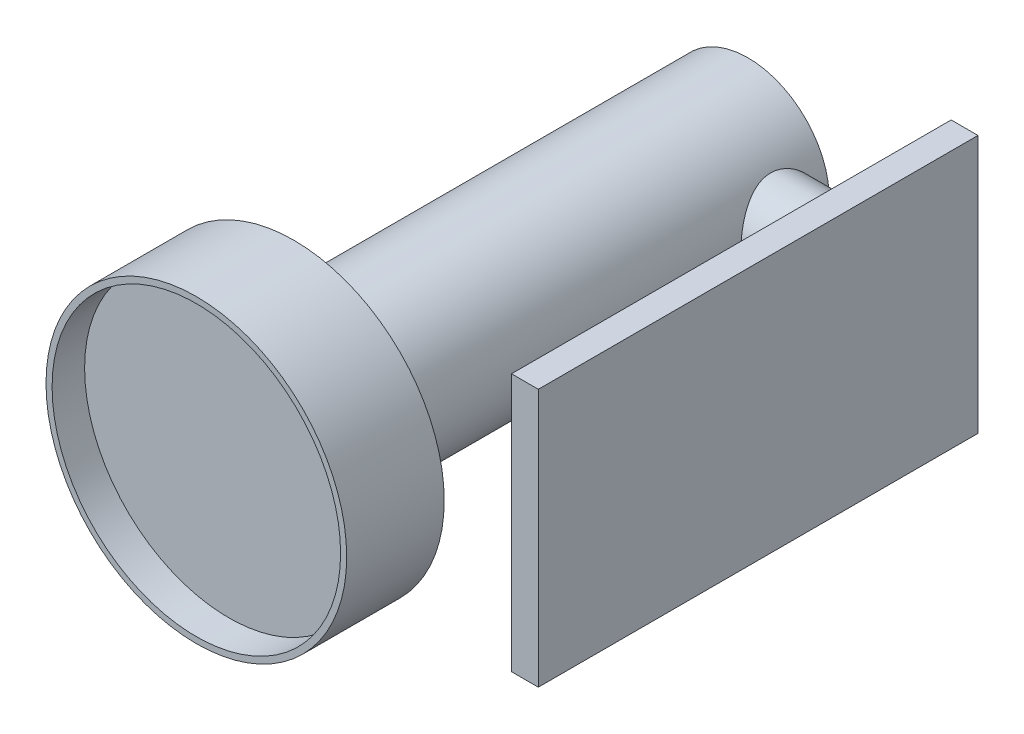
SolidWorks part; units mm, degrees
ref_plane "Front Plane" through (0, 0, 0) normal (0, 0, 1) x (1, 0, 0)
ref_plane "Top Plane" through (0, 0, 0) normal (0, 1, 0) x (1, 0, 0)
ref_plane "Right Plane" through (0, 0, 0) normal (1, 0, 0) x (0, 0, -1)
sketch "Sketch1" plane through (0, 0, 0) normal (0, 0, 1) x (1, 0, 0)
  circle A0 centre (0, 0) radius 18.5
  dimension "D1" = 37
extrude "Boss-Extrude1" add sketch "Sketch1" along normal blind 12
sketch "Sketch2" plane through (0, 0, 12) normal (0, 0, 1) x (1, 0, 0)
  circle A0 centre (0, 0) radius 17.75
  dimension "D1" = 35.5
extrude "Cut-Extrude1" cut sketch "Sketch2" against normal blind 4 contours A0
sketch "Sketch3" plane through (0, 0, 0) normal (0, 0, -1) x (-1, 0, 0)
  circle A0 centre (0, 0) radius 10
  dimension "D1" = 20
extrude "Boss-Extrude2" add sketch "Sketch3" along normal blind 55.88
sketch "Sketch4" plane through (0, 0, 0) normal (1, 0, 0) x (0, 0, -1)
  circle A1 centre (50.0046, 0) radius 5
  dimension "D2" = 10
extrude "Boss-Extrude3" add sketch "Sketch4" along normal blind 25
sketch "Sketch6" plane through (25, 0, 0) normal (1, 0, 0) x (0, 0, -1)
  line L0 (35.4032, 0) -> (-23.2179, 0) construction
  line L1 (55.88, 0) -> (55.88, 15.875)
  line L2 (55.88, -10) -> (55.88, 10) construction
  line L3 (55.88, 15.875) -> (1.778, 15.875)
  line L4 (1.778, 15.875) -> (1.778, -15.875)
  line L5 (1.778, -15.875) -> (55.88, -15.875)
  line L6 (55.88, -15.875) -> (55.88, 0)
  dimension "D1" = 15.875
  dimension "D2" = 54.102
  dimension "D3" = 31.75
extrude "Boss-Extrude5" add sketch "Sketch6" along normal blind 3.302
